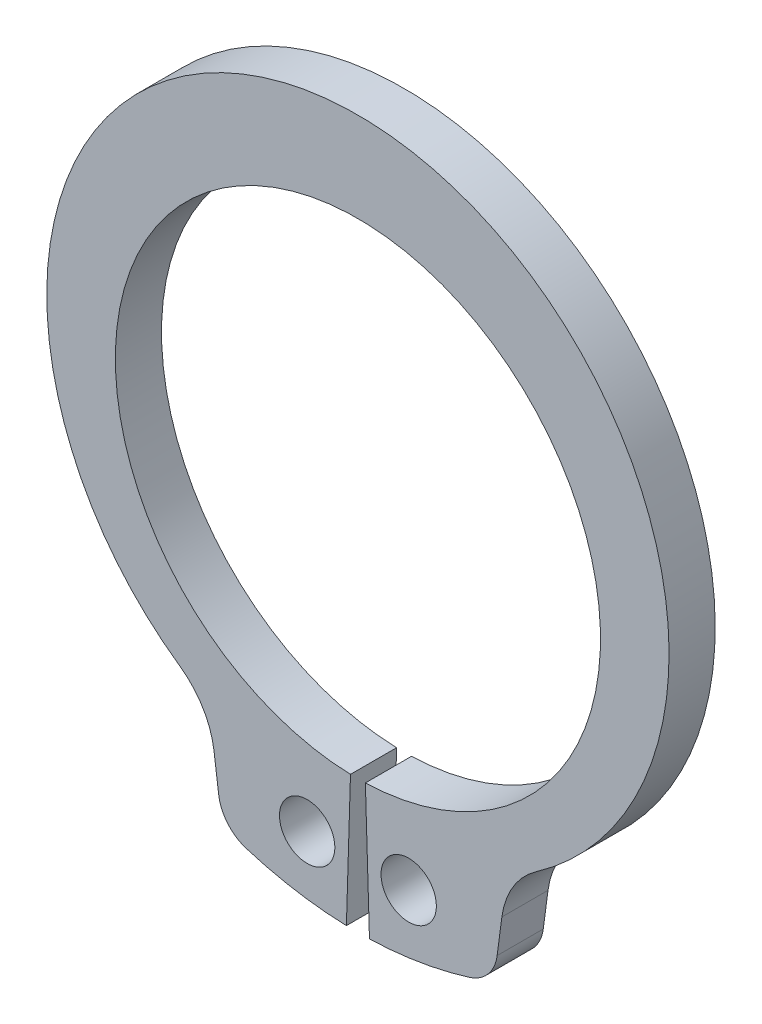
SolidWorks part; units mm, degrees
ref_plane "Plane1" through (0, 0, 0) normal (0, 0, 1) x (1, 0, 0)
ref_plane "Plane2" through (0, 0, 0) normal (0, 1, 0) x (1, 0, 0)
ref_plane "Plane3" through (0, 0, 0) normal (1, 0, 0) x (0, 0, -1)
sketch "Clipboard" plane through (0, 0, 0) normal (0, 0, 1) x (1, 0, 0)
  line L0 (0, 0) -> (1.7272, 0)
  line L1 (0, 0) -> (0, 0.9906)
  line L2 (0, 0) -> (0, -2.5654)
  circle A0 centre (0, 0) radius 0.5334
  circle A1 centre (0, 0) radius 5.0038
  dimension "HoleDia" = 1.0668
  dimension "ShaftDia" = 10.0076
  dimension "LargeSection" = 1.7272
  dimension "SmallSection" = 0.9906
  dimension "LugSection" = 2.5654
sketch "BodySke" plane through (0, 0, 0) normal (0, 0, 1) x (1, 0, 0)
  line L0 (-1.5431, 0) -> (1.5431, 0) construction
  line L1 (0, 0) -> (0, 6.4008) construction
  line L2 (0.1435, -4.6714) -> (0.2223, -7.2356)
  line L3 (-0.1435, -4.6714) -> (-0.2223, -7.2356)
  line L4 (0, 0) -> (4.3333, -5.7988) construction
  line L5 (0, 0) -> (-4.3333, -5.7988) construction
  line L7 (2.773, -5.5934) -> (2.6821, -6.2833)
  line L8 (-2.773, -5.5934) -> (-2.6821, -6.2833)
  circle A0 centre (0, 0) radius 4.6736 construction
  arc A1 (0.1435, -4.6714) -> (-0.1435, -4.6714) centre (0, 0) ccw
  arc A2 (3.3906, -4.5373) -> (-3.3906, -4.5373) centre (0, 0.4062) ccw construction
  arc A3 (0.2223, -7.2356) -> (2.1533, -6.9113) centre (0, 0) ccw
  arc A4 (3.4322, -4.5085) -> (2.773, -5.5934) centre (4.3333, -5.7988) ccw
  arc A5 (-2.773, -5.5934) -> (-3.4322, -4.5085) centre (-4.3333, -5.7988) ccw
  arc A6 (-2.1533, -6.9113) -> (-0.2223, -7.2356) centre (0, 0) ccw
  arc A7 (3.4322, -4.5085) -> (-3.4322, -4.5085) centre (0, 0.4062) ccw
  arc A8 (-2.7922, -5.4475) -> (2.7922, -5.4475) centre (0, 0) ccw construction
  circle A9 centre (0.9779, -6.0428) radius 0.5334
  circle A10 centre (-0.9779, -6.0428) radius 0.5334
  arc A11 (2.6821, -6.2833) -> (2.1533, -6.9113) centre (1.9267, -6.1838) cw
  arc A12 (-2.6821, -6.2833) -> (-2.1533, -6.9113) centre (-1.9267, -6.1838) ccw
  point P28 (2.621, -6.7479)
  point P31 (-2.621, -6.7479)
  dimension "GrooveDia" = 9.3472
  dimension "D3" = 0.762
  dimension "LugRad" = 7.239
  dimension "HoleOffsetRad" = 6.1214
  dimension "HoleDia" = 1.0668
  dimension "D2" = 15
  dimension "LargeRad" = 6.4008
  dimension "SmallRad" = 5.6642
  dimension "Gap" = 0.4445
  dimension "SmallAngle" = 73.54
  dimension "HoleSpacing" = 1.9558
extrude "Body" add sketch "BodySke" against normal blind 0.889
equation "' \"ShaftDia@Clipboard\" = 0.394"
equation "' \"Thickness@Body\" = 0.035"
equation "' \"GrooveDia@BodySke\" = 0.368"
equation "' \"LugSection@Clipboard\" = 0.101"
equation "' \"LargeSection@Clipboard\" = 0.068"
equation "' \"SmallSection@Clipboard\" = 0.039"
equation "' \"HoleDia@Clipboard\" = 0.042"
equation "\"Gap@BodySke\" =  \"Thickness@Body\" / 2"
equation "\"LargeRad@BodySke\" =  \"GrooveDia@BodySke\" / 2 +  \"LargeSection@Clipboard\""
equation "\"SmallRad@BodySke\" =  \"GrooveDia@BodySke\" / 2 +  \"SmallSection@Clipboard\""
equation "\"LugRad@BodySke\" = \"GrooveDia@BodySke\" / 2 + \"LugSection@Clipboard\""
equation "\"HoleOffsetRad@BodySke\" = (  \"ShaftDia@Clipboard\" / 2 + \"LugRad@BodySke\" ) / 2"
equation "\"HoleSpacing@BodySke\" = \"Gap@BodySke\"  * 2 +  \"HoleDia@Clipboard\""
equation "\"HoleDia@BodySke\" =  \"HoleDia@Clipboard\""
equation "\"SmallAngle@BodySke\" = atn(\"HoleSpacing@BodySke\" / 2 / sqr(\"HoleOffsetRad@BodySke\"  * \"HoleOffsetRad@BodySke\" - (\"HoleSpacing@BodySke\" / 2) * (\"HoleSpacing@BodySke\" / 2) ))  * 8 * ( 180 / 3.141593)"
